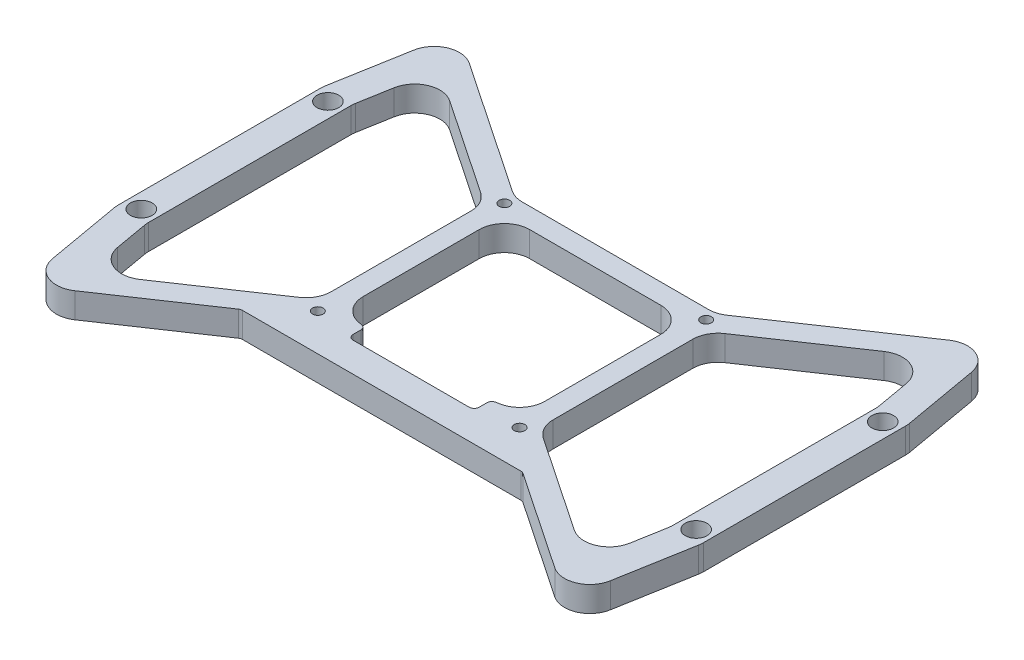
SolidWorks part; units mm, degrees
ref_plane "Front Plane" through (0, 0, 0) normal (0, 0, 1) x (1, 0, 0)
ref_plane "Top Plane" through (0, 0, 0) normal (0, 1, 0) x (1, 0, 0)
ref_plane "Right Plane" through (0, 0, 0) normal (1, 0, 0) x (0, 0, -1)
sketch "Sketch1" plane through (0, 0, 0) normal (0, 1, 0) x (1, 0, 0)
  line L0 (0, 18.5) -> (0, -18.5) construction
  line L1 (55, -18.5) -> (-55, -18.5) construction
  line L2 (55, -18.5) -> (55, 18.5) construction
  line L3 (55, 18.5) -> (-55, 18.5) construction
  line L4 (-55, -18.5) -> (-55, 18.5) construction
  line L5 (55, -18.5) -> (-55, 18.5) construction
  line L6 (55, 18.5) -> (-55, -18.5) construction
  line L26 (20, 18.5) -> (20, -18.5) construction
  line L42 (52, 20.5) -> (52, -20.5)
  line L43 (-58, 0) -> (58, 0) construction
  line L44 (-55, 0) -> (55, 0) construction
  line L45 (-55, 18.5) -> (-55, -18.5) construction
  line L46 (-58, 20.5) -> (-58, -20.5)
  line L47 (-49.4433, 35) -> (-52, 20.5)
  line L48 (-52, 20.5) -> (-52, -20.5)
  line L49 (-58, 20.5) -> (-58, 30.119) construction
  line L50 (-58, 20.5) -> (-53.963, 43.3951)
  line L51 (-53.963, 43.3951) -> (-20, 20.5)
  line L52 (-20, 20.5) -> (20, 20.5)
  line L53 (0, -55) -> (0, 55) construction
  line L54 (22, 16.5) -> (-22, 16.5)
  line L55 (-22, 16.5) -> (-49.4433, 35)
  line L56 (58, 20.5) -> (58, -20.5)
  line L57 (-22, 16.5) -> (-22, -16.5)
  line L58 (58, 20.5) -> (53.963, 43.3951)
  line L59 (49.4433, 35) -> (52, 20.5)
  line L60 (22, 16.5) -> (49.4433, 35)
  line L61 (53.963, 43.3951) -> (20, 20.5)
  line L62 (49.4433, -35) -> (52, -20.5)
  line L63 (58, -20.5) -> (53.963, -43.3951)
  line L64 (53.963, -43.3951) -> (20, -20.5)
  line L65 (22, -16.5) -> (49.4433, -35)
  line L66 (22, -16.5) -> (-22, -16.5)
  line L67 (-20, -20.5) -> (20, -20.5)
  line L68 (-53.963, -43.3951) -> (-20, -20.5)
  line L69 (-22, -16.5) -> (-49.4433, -35)
  line L70 (-49.4433, -35) -> (-52, -20.5)
  line L71 (-58, -20.5) -> (-53.963, -43.3951)
  line L72 (-18, 16.5) -> (-18, -16.5)
  line L73 (-20, 18.5) -> (-20, -18.5) construction
  line L74 (22, 16.5) -> (22, -16.5)
  line L75 (18, 16.5) -> (18, -16.5)
  circle A0 centre (-20, 18.5) radius 1.05
  circle A1 centre (20, 18.5) radius 1.05
  circle A2 centre (20, -18.5) radius 1.05
  circle A3 centre (-20, -18.5) radius 1.05
  circle A4 centre (-55, 18.5) radius 2.15
  circle A5 centre (-55, -18.5) radius 2.15
  circle A6 centre (55, -18.5) radius 2.15
  circle A7 centre (55, 18.5) radius 2.15
  point P0 (0, 0)
  point P16 (0, 0)
  point P47 (0, 20.5)
  point P53 (0, 16.5)
  point P60 (52, 0)
  point P69 (-52, 0)
  dimension "D4" = 2.1
  dimension "D6" = 4.3
  dimension "D1" = 37
  dimension "D2" = 35
  dimension "D3" = 40
  dimension "D5" = 4
  dimension "D7" = 110
  dimension "D8" = 6
  dimension "D9" = 10
  dimension "D10" = 4
extrude "Boss-Extrude1" add sketch "Sketch1" along normal blind 5 contours L72 L54 L57 L66 | L46 L71 L68 L67 L64 L63 L56 L58 L61 L52 L51 L50 A7 A6 A5 A4 A3 A2 A1 A0 L69 L70 L48 L47 L55 L54 L60 L59 L42 L62 L65 L66 | L54 L75 L66 L74
fillet "Fillet1" radius 5 28 edges at (-52, 2.5, 20.5) (-49.4433, 2.5, 35) (-52, 2.5, -20.5) (-49.4433, 2.5, -35) (-22, 2.5, -16.5) (-22, 2.5, 16.5) (22, 2.5, 16.5) (22, 2.5, -16.5) (49.4433, 2.5, -35) (52, 2.5, -20.5) (52, 2.5, 20.5) (49.4433, 2.5, 35) (-18, 2.5, -16.5) (18, 2.5, -16.5) (18, 2.5, 16.5) (-18, 2.5, 16.5) (-20, 2.5, 20.5) (20, 2.5, 20.5) (53.963, 2.5, 43.3951) (58, 2.5, 20.5) (58, 2.5, -20.5) (53.963, 2.5, -43.3951) (20, 2.5, -20.5) (-20, 2.5, -20.5) (-53.963, 2.5, -43.3951) (-58, 2.5, -20.5) (-58, 2.5, 20.5) (-53.963, 2.5, 43.3951)
sketch "Sketch2" plane through (0, 5, 0) normal (0, 1, 0) x (1, 0, 0)
  line L0 (13, -16.5) -> (-13, -16.5) construction
  line L1 (-12.5, -16.5) -> (12.5, -16.5)
  line L2 (-12.5, -16.5) -> (-12.5, -20)
  line L3 (-12.5, -20) -> (12.5, -20)
  line L4 (12.5, -16.5) -> (12.5, -20)
  line L5 (0, -2.75) -> (0, 2.75) construction
  point P6 (0, -20)
  dimension "D1" = 25
  dimension "D2" = 3.5
extrude "Cut-Extrude1" cut sketch "Sketch2" against normal through all
sketch "Sketch3" plane through (0, 5, 0) normal (0, 1, 0) x (1, 0, 0)
  line L0 (-18.4721, -20.5) -> (18.4721, -20.5) construction
  line L1 (-27.9337, -20.5) -> (27.9337, -20.5)
  line L2 (-27.9337, -20.5) -> (-27.9337, -25.8482)
  line L3 (-27.9337, -25.8482) -> (27.9337, -25.8482)
  line L4 (27.9337, -20.5) -> (27.9337, -25.8482)
  line L5 (-24.2051, -17.9865) -> (-43.0609, -30.6976) construction
  line L6 (-47.5807, -39.0926) -> (-21.2669, -21.3541) construction
  line L7 (47.5807, -39.0926) -> (21.2669, -21.3541) construction
  point P6 (-27.0753, -24.3604)
  point P7 (0, 0)
  point P10 (0, 0)
  point P13 (0, 0)
extrude "Boss-Extrude2" add sketch "Sketch3" against normal up to surface (5 mm away)
fillet "Fillet2" radius 1 6 edges at (27.9337, 2.5, 25.8482) (-27.9337, 2.5, 25.8482) (-12.5, 2.5, 16.5) (-12.5, 2.5, 20) (12.5, 2.5, 20) (12.5, 2.5, 16.5)
